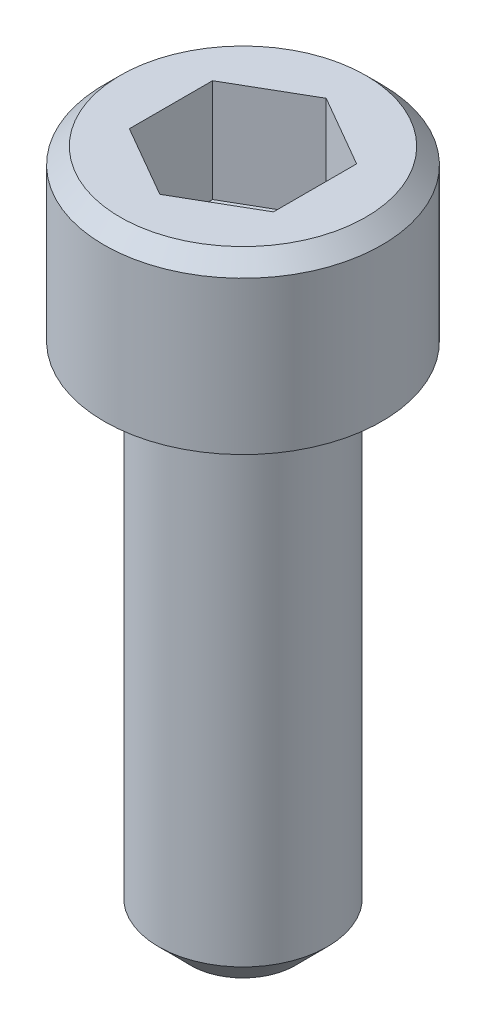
SolidWorks part; units mm, degrees
ref_plane "Front" through (0, 0, 0) normal (0, 0, 1) x (1, 0, 0)
ref_plane "Top" through (0, 0, 0) normal (0, 1, 0) x (1, 0, 0)
ref_plane "Right" through (0, 0, 0) normal (1, 0, 0) x (0, 0, -1)
sketch "Sketch1" plane through (0, 0, 0) normal (0, 0, 1) x (1, 0, 0)
  line L0 (0, 0) -> (3.429, 0)
  line L1 (3.429, 0) -> (3.429, 3.7687)
  line L2 (3.429, 3.7687) -> (3.0321, 4.1656)
  line L3 (3.0321, 4.1656) -> (0, 4.1656)
  line L4 (0, 4.1656) -> (0, 0)
  line L5 (0, 0) -> (0, 13.4364) construction
  dimension "D1" = 3.429
  dimension "D2" = 4.1656
  dimension "D3" = 135
  dimension "D4" = 0.3969
revolve "Base-Revolve" add sketch "Sketch1" angle 360 about L5
sketch "Sketch2" plane through (0, 0, 0) normal (0, 0, 1) x (1, 0, 0)
  line L0 (0, 0) -> (0, 21.2539) construction
  line L1 (0, -12.7) -> (1.2905, -12.7)
  line L2 (1.2905, -12.7) -> (2.0828, -11.9044)
  line L3 (2.0828, -11.9044) -> (2.0828, 0)
  line L4 (2.0828, 0) -> (0, 0)
  line L5 (0, 0) -> (0, -12.7)
  dimension "D1" = 12.7
  dimension "D2" = 2.0828
  dimension "D3" = 0.7923
  dimension "D4" = 0.7956
revolve "Boss-Revolve1" add sketch "Sketch2"
ref_plane "Plane4" through (0, 8, 0) normal (0, 1, 0) x (-1, 0, 0)
sketch "Sketch3" plane through (0, 4.1656, 0) normal (0, 1, 0) x (-1, 0, 0)
  line L0 (1.778, 1.0265) -> (0, 2.0531)
  line L1 (0, 2.0531) -> (-1.778, 1.0265)
  line L2 (-1.778, 1.0265) -> (-1.778, -1.0265)
  line L3 (-1.778, -1.0265) -> (0, -2.0531)
  line L4 (0, -2.0531) -> (1.778, -1.0265)
  line L5 (1.778, -1.0265) -> (1.778, 1.0265)
  point P6 (1.778, 0)
  dimension "D1" = 120
  dimension "D2" = 3.556
  dimension "D3" = 120
extrude "Cut-Extrude1" cut sketch "Sketch3" against normal blind 2.54
